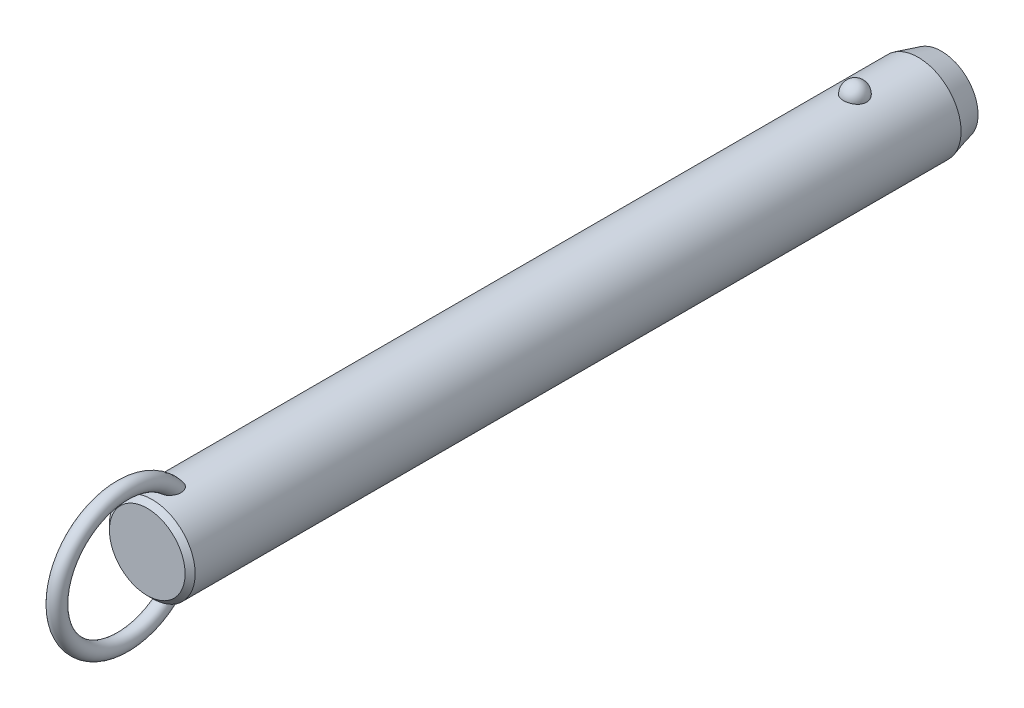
SolidWorks part; units mm, degrees
ref_plane "Front Plane" through (0, 0, 0) normal (0, 0, 1) x (1, 0, 0)
ref_plane "Top Plane" through (0, 0, 0) normal (0, 1, 0) x (1, 0, 0)
ref_plane "Right Plane" through (0, 0, 0) normal (1, 0, 0) x (0, 0, -1)
sketch "Sketch2" plane through (0, 0, 0) normal (0, 0, 1) x (1, 0, 0)
  circle A0 centre (0, 0) radius 11.1
  point P3 (0, 11.1)
  dimension "D1" = 22.2
extrude "Boss-Extrude1" add sketch "Sketch2" along normal blind 167.6
sketch "Sketch3" plane through (0, 0, 0) normal (0, 0, -1) x (-1, 0, 0)
  circle A0 centre (0, 0) radius 11.1
  dimension "D1" = 22.2
extrude "Boss-Extrude2" add sketch "Sketch3" along normal blind 25.4
chamfer "Chamfer1" distance 6 angle 15 1 edges at (-11.1, 0, -25.4)
sketch "Sketch12" plane through (0, 0, 0) normal (1, 0, 0) x (0, 0, -1)
  line L0 (-167.6, 11.1) -> (-167.6, -11.1) construction
  point P0 (-167.6, 0)
sketch "Sketch13" plane through (0, 0, 0) normal (1, 0, 0) x (0, 0, -1)
  circle A0 centre (-186.65, 0) radius 19.05
  point P2 (-167.6, 0)
  dimension "D1" = 38.1
sketch "Sketch14" plane through (0, 0, 0) normal (0, 1, 0) x (1, 0, 0)
  circle A0 centre (0, -169.6) radius 2
  point P2 (0, -167.6)
  dimension "D1" = 4
sweep "Sweep1" add profiles "Sketch14" path "Sketch13"
sketch "Sketch15" plane through (0, 0, 167.6) normal (0, 0, 1) x (1, 0, 0)
  circle A0 centre (0, 0) radius 11.1
  dimension "D1" = 22.2
extrude "Boss-Extrude3" add sketch "Sketch15" along normal blind 12.7
chamfer "Chamfer2" distance 1.3 angle 45 1 edges at (11.1, 0, 180.3)
sketch "Sketch18" plane through (0, 0, 0) normal (1, 0, 0) x (0, 0, -1)
  line L0 (19.4, 11.1) -> (-171.168, 11.1) construction
  line L1 (3, 14.1) -> (3, 8.1)
  line L2 (-171.168, -11.1) -> (19.4, -11.1) construction
  arc A0 (3, 14.1) -> (3, 8.1) centre (3, 11.1) ccw
  point P4 (0, 11.1)
  dimension "D1" = 25.2
revolve "Revolve1" add sketch "Sketch18" angle 360 about L1
